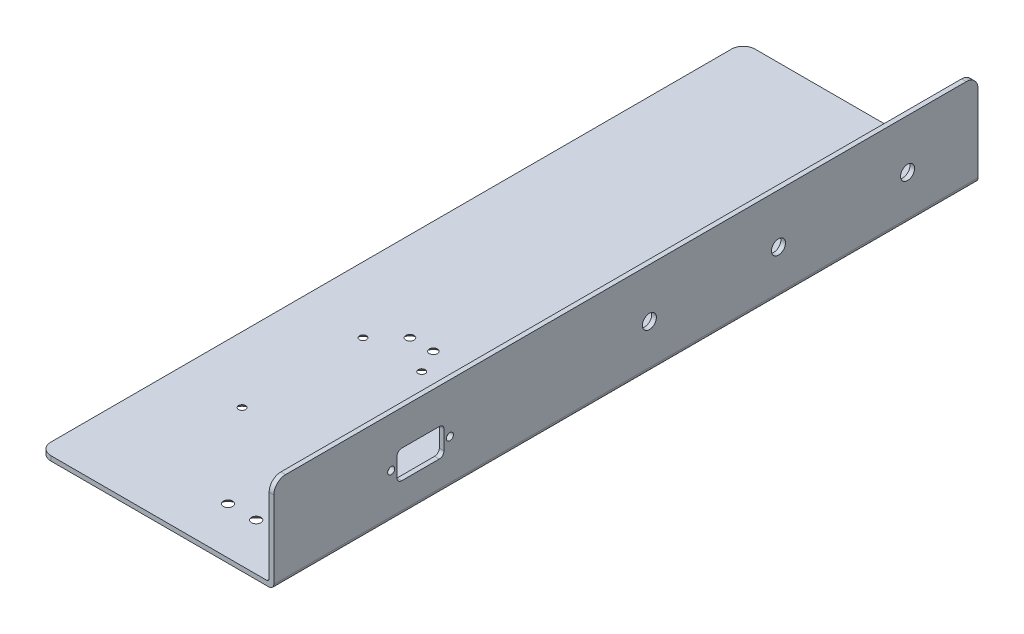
SolidWorks part; units mm, degrees
ref_plane "Plan de face" through (0, 0, 0) normal (0, 0, 1) x (1, 0, 0)
ref_plane "Plan de dessus" through (0, 0, 0) normal (0, 1, 0) x (1, 0, 0)
ref_plane "Plan de droite" through (0, 0, 0) normal (1, 0, 0) x (0, 0, -1)
sketch "Esquisse1" plane through (0, 0, 0) normal (0, 0, 1) x (1, 0, 0)
  line L0 (-100, 0) -> (0, 0)
  line L1 (0, 0) -> (0, 40)
  line L2 (0, 40) -> (-2, 40)
  line L3 (-2, 40) -> (-2, 2)
  line L4 (-2, 2) -> (-100, 2)
  line L5 (-100, 2) -> (-100, 0)
  dimension "D1" = 40
  dimension "D2" = 2
  dimension "D3" = 2
  dimension "D4" = 100
extrude "Boss.-Extru.1" add sketch "Esquisse1" along normal blind 300
sketch "Esquisse2" plane through (0, 0, 0) normal (1, 0, 0) x (0, 0, -1)
  line L0 (-300, 0) -> (-300, 40) construction
  line L1 (-247.5, 25) -> (-227.5, 25)
  line L2 (-300, 0) -> (0, 0) construction
  line L3 (7.6268, 19) -> (-351.7119, 19) construction
  line L4 (0, 40) -> (0, 2) construction
  line L5 (-247.5, 25) -> (-247.5, 13)
  line L6 (-247.5, 13) -> (-227.5, 13)
  line L7 (-227.5, 25) -> (-227.5, 13)
  circle A0 centre (-30, 19) radius 3
  circle A1 centre (-85, 19) radius 3
  circle A2 centre (-140, 19) radius 3
  circle A3 centre (-250, 19) radius 1.5
  circle A4 centre (-225, 19) radius 1.5
  dimension "D2" = 30
  dimension "D4" = 55
  dimension "D5" = 6
  dimension "D6" = 6
  dimension "D7" = 6
  dimension "D8" = 20
  dimension "D13" = 3
  dimension "D14" = 3
  dimension "D1" = 19
  dimension "D3" = 85
  dimension "D9" = 25
  dimension "D10" = 6
  dimension "D11" = 12
  dimension "D12" = 2.5
  dimension "D15" = 50
extrude "Enlèv. mat.-Extru.2" cut sketch "Esquisse2" against normal through all
fillet "Congé1" radius 1 1 edges at (-2, 2, 150)
fillet "Congé2" radius 2 1 edges at (0, 0, 150)
sketch "Esquisse3" plane through (0, 0, 0) normal (0, -1, 0) x (1, 0, 0)
  line L0 (-72, 275.5516) -> (-72, 185.3611) construction
  line L1 (-47, 275.5516) -> (-47, 185.3611) construction
  line L2 (-95.8389, 241.5) -> (18.5879, 241.5) construction
  line L3 (-90.6738, 190) -> (15.8067, 190) construction
  line L4 (0, 300) -> (0, 0) construction
  line L5 (-100, 300) -> (-2, 300) construction
  line L6 (-90.6738, 180) -> (-16.7576, 180) construction
  line L7 (-100, 300) -> (-100, 0) construction
  circle A0 centre (-72, 241.5) radius 1.5
  circle A1 centre (-62, 180) radius 1.75
  circle A2 centre (-47, 190) radius 1.5
  circle A3 centre (-72, 190) radius 1.5
  circle A4 centre (-52, 180) radius 1.75
  dimension "D1" = 47
  dimension "D3" = 3
  dimension "D4" = 10
  dimension "D5" = 3
  dimension "D6" = 3
  dimension "D9" = 38
  dimension "D10" = 3.5
  dimension "D11" = 3.5
  dimension "D2" = 72
  dimension "D7" = 51.5
  dimension "D8" = 58.5
  dimension "D12" = 10
extrude "Enlèv. mat.-Extru.3" cut sketch "Esquisse3" against normal blind 10
chamfer "Chanfrein1" distance 2 angle 45 5 edges at (-72, 0, 240) (-47, 0, 188.5) (-72, 0, 188.5) (-52, 0, 178.25) (-62, 0, 178.25)
sketch "Esquisse4" plane through (0, 0, 0) normal (0, -1, 0) x (1, 0, 0)
  line L0 (-39.5, 307.9499) -> (-39.5, 265.1304) construction
  line L1 (-27.5, 307.9499) -> (-27.5, 263.7782) construction
  line L2 (-95.3784, 280) -> (-24.8389, 280) construction
  line L3 (0, 300) -> (0, 0) construction
  line L5 (-100, 300) -> (-2, 300) construction
  circle A0 centre (-27.5, 280) radius 2
  circle A1 centre (-39.5, 280) radius 2
  dimension "D2" = 20
  dimension "D3" = 12
  dimension "D4" = 4
  dimension "D5" = 4
  dimension "D1" = 27.5
extrude "Enlèv. mat.-Extru.4" cut sketch "Esquisse4" against normal through all
chamfer "Chanfrein2" distance 2 angle 45 2 edges at (-27.5, 0, 278) (-39.5, 0, 278)
fillet "Congé3" radius 5 4 edges at (-1, 40, 0) (-100, 1, 0) (-100, 1, 300) (-1, 40, 300)
fillet "Congé4" radius 2 4 edges at (-1, 25, 227.5) (-1, 13, 227.5) (-1, 13, 247.5) (-1, 25, 247.5)
